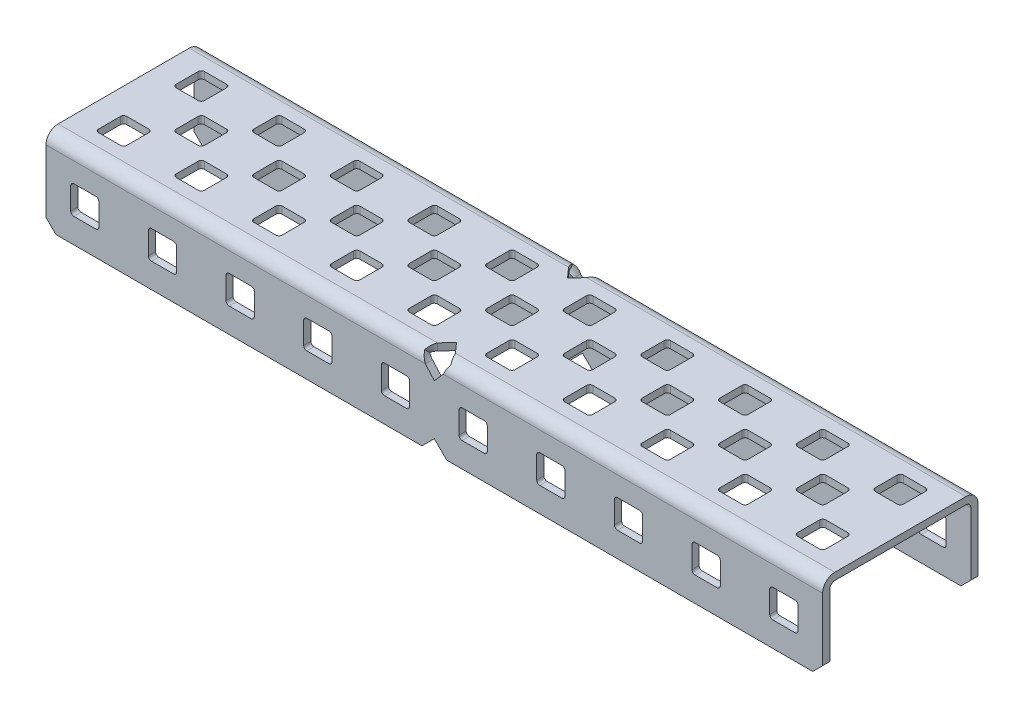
SolidWorks part; units mm, degrees
ref_plane "Front Plane" through (0, 0, 0) normal (0, 0, 1) x (1, 0, 0)
ref_plane "Top Plane" through (0, 0, 0) normal (0, 1, 0) x (1, 0, 0)
ref_plane "Right Plane" through (0, 0, 0) normal (1, 0, 0) x (0, 0, -1)
imported_body "Imported3"
sketch "Sketch1" plane through (0, 0, -14.4322) normal (0, 0, 1) x (1, 0, 0)
  line L0 (35.0078, -12.7) -> (39.0618, -12.7)
  line L1 (39.0618, -12.7) -> (37.0348, -10.673)
  line L2 (37.0348, -10.673) -> (35.0078, -12.7)
extrude "Cut-Extrude1" cut sketch "Sketch1" against normal through all
sketch "Sketch2" plane through (0, 0, 8.631) normal (0, 0, -1) x (-1, 0, 0)
  line L0 (-39.0618, -12.7) -> (-35.0078, -12.7)
  line L1 (-35.0078, -12.7) -> (-37.0348, -10.673)
  line L2 (-37.0348, -10.673) -> (-39.0618, -12.7)
extrude "Cut-Extrude2" cut sketch "Sketch2" against normal through all
sketch "Sketch3" plane through (0, 1.1684, 0) normal (0, 1, 0) x (-1, 0, 0)
  line L0 (-90.1462, -0.5892) -> (-90.1462, -5.212)
  line L1 (-90.1462, -5.212) -> (-85.5234, -5.212)
  line L2 (-85.5234, -5.212) -> (-85.5234, -0.5892)
  line L3 (-85.5234, -0.5892) -> (-90.1462, -0.5892)
extrude "Cut-Extrude3" cut sketch "Sketch3" against normal through all
sketch "Sketch4" plane through (0, 1.1684, 0) normal (0, 1, 0) x (-1, 0, 0)
  line L0 (-77.4462, -0.5892) -> (-77.4462, -5.212)
  line L1 (-77.4462, -5.212) -> (-72.8234, -5.212)
  line L2 (-72.8234, -5.212) -> (-72.8234, -0.5892)
  line L3 (-72.8234, -0.5892) -> (-77.4462, -0.5892)
extrude "Cut-Extrude4" cut sketch "Sketch4" against normal through all
sketch "Sketch5" plane through (0, 1.1684, 0) normal (0, 1, 0) x (-1, 0, 0)
  line L0 (-64.7462, -0.5892) -> (-64.7462, -5.212)
  line L1 (-64.7462, -5.212) -> (-60.1234, -5.212)
  line L2 (-60.1234, -5.212) -> (-60.1234, -0.5892)
  line L3 (-60.1234, -0.5892) -> (-64.7462, -0.5892)
extrude "Cut-Extrude5" cut sketch "Sketch5" against normal through all
sketch "Sketch6" plane through (0, 1.1684, 0) normal (0, 1, 0) x (-1, 0, 0)
  line L0 (-52.0462, -0.5892) -> (-52.0462, -5.212)
  line L1 (-52.0462, -5.212) -> (-47.4234, -5.212)
  line L2 (-47.4234, -5.212) -> (-47.4234, -0.5892)
  line L3 (-47.4234, -0.5892) -> (-52.0462, -0.5892)
extrude "Cut-Extrude6" cut sketch "Sketch6" against normal through all
sketch "Sketch7" plane through (0, 1.1684, 0) normal (0, 1, 0) x (-1, 0, 0)
  line L0 (-39.3462, -0.5892) -> (-39.3462, -5.212)
  line L1 (-39.3462, -5.212) -> (-34.7234, -5.212)
  line L2 (-34.7234, -5.212) -> (-34.7234, -0.5892)
  line L3 (-34.7234, -0.5892) -> (-39.3462, -0.5892)
extrude "Cut-Extrude7" cut sketch "Sketch7" against normal through all
sketch "Sketch8" plane through (0, 1.1684, 0) normal (0, 1, 0) x (-1, 0, 0)
  line L0 (-26.6462, -0.5892) -> (-26.6462, -5.212)
  line L1 (-26.6462, -5.212) -> (-22.0234, -5.212)
  line L2 (-22.0234, -5.212) -> (-22.0234, -0.5892)
  line L3 (-22.0234, -0.5892) -> (-26.6462, -0.5892)
extrude "Cut-Extrude8" cut sketch "Sketch8" against normal through all
sketch "Sketch9" plane through (0, 1.1684, 0) normal (0, 1, 0) x (-1, 0, 0)
  line L0 (-13.9462, -0.5892) -> (-13.9462, -5.212)
  line L1 (-13.9462, -5.212) -> (-9.3234, -5.212)
  line L2 (-9.3234, -5.212) -> (-9.3234, -0.5892)
  line L3 (-9.3234, -0.5892) -> (-13.9462, -0.5892)
extrude "Cut-Extrude9" cut sketch "Sketch9" against normal through all
sketch "Sketch10" plane through (0, 1.1684, 0) normal (0, 1, 0) x (-1, 0, 0)
  line L0 (17.8038, -6.9392) -> (17.8038, -11.562)
  line L1 (17.8038, -11.562) -> (22.4266, -11.562)
  line L2 (22.4266, -11.562) -> (22.4266, -6.9392)
  line L3 (22.4266, -6.9392) -> (17.8038, -6.9392)
extrude "Cut-Extrude10" cut sketch "Sketch10" against normal through all
sketch "Sketch11" plane through (0, 1.1684, 0) normal (0, 1, 0) x (-1, 0, 0)
  line L0 (17.8038, 5.7608) -> (17.8038, 1.138)
  line L1 (17.8038, 1.138) -> (22.4266, 1.138)
  line L2 (22.4266, 1.138) -> (22.4266, 5.7608)
  line L3 (22.4266, 5.7608) -> (17.8038, 5.7608)
extrude "Cut-Extrude11" cut sketch "Sketch11" against normal through all
sketch "Sketch12" plane through (0, 1.1684, 0) normal (0, 1, 0) x (-1, 0, 0)
  line L0 (11.4538, -0.5892) -> (11.4538, -5.212)
  line L1 (11.4538, -5.212) -> (16.0766, -5.212)
  line L2 (16.0766, -5.212) -> (16.0766, -0.5892)
  line L3 (16.0766, -0.5892) -> (11.4538, -0.5892)
extrude "Cut-Extrude12" cut sketch "Sketch12" against normal through all
sketch "Sketch13" plane through (0, 1.1684, 0) normal (0, 1, 0) x (-1, 0, 0)
  line L0 (5.1038, -6.9392) -> (5.1038, -11.562)
  line L1 (5.1038, -11.562) -> (9.7266, -11.562)
  line L2 (9.7266, -11.562) -> (9.7266, -6.9392)
  line L3 (9.7266, -6.9392) -> (5.1038, -6.9392)
extrude "Cut-Extrude13" cut sketch "Sketch13" against normal through all
sketch "Sketch14" plane through (0, 1.1684, 0) normal (0, 1, 0) x (-1, 0, 0)
  line L0 (5.1038, 5.7608) -> (5.1038, 1.138)
  line L1 (5.1038, 1.138) -> (9.7266, 1.138)
  line L2 (9.7266, 1.138) -> (9.7266, 5.7608)
  line L3 (9.7266, 5.7608) -> (5.1038, 5.7608)
extrude "Cut-Extrude14" cut sketch "Sketch14" against normal through all
sketch "Sketch15" plane through (0, 1.1684, 0) normal (0, 1, 0) x (-1, 0, 0)
  line L0 (-7.5962, -6.9392) -> (-7.5962, -11.562)
  line L1 (-7.5962, -11.562) -> (-2.9734, -11.562)
  line L2 (-2.9734, -11.562) -> (-2.9734, -6.9392)
  line L3 (-2.9734, -6.9392) -> (-7.5962, -6.9392)
extrude "Cut-Extrude15" cut sketch "Sketch15" against normal through all
sketch "Sketch16" plane through (0, 1.1684, 0) normal (0, 1, 0) x (-1, 0, 0)
  line L0 (-7.5962, 5.7608) -> (-7.5962, 1.138)
  line L1 (-7.5962, 1.138) -> (-2.9734, 1.138)
  line L2 (-2.9734, 1.138) -> (-2.9734, 5.7608)
  line L3 (-2.9734, 5.7608) -> (-7.5962, 5.7608)
extrude "Cut-Extrude16" cut sketch "Sketch16" against normal through all
sketch "Sketch17" plane through (0, 1.1684, 0) normal (0, 1, 0) x (-1, 0, 0)
  line L0 (-20.2962, -6.9392) -> (-20.2962, -11.562)
  line L1 (-20.2962, -11.562) -> (-15.6734, -11.562)
  line L2 (-15.6734, -11.562) -> (-15.6734, -6.9392)
  line L3 (-15.6734, -6.9392) -> (-20.2962, -6.9392)
extrude "Cut-Extrude17" cut sketch "Sketch17" against normal through all
sketch "Sketch18" plane through (0, 1.1684, 0) normal (0, 1, 0) x (-1, 0, 0)
  line L0 (-20.2962, 5.7608) -> (-20.2962, 1.138)
  line L1 (-20.2962, 1.138) -> (-15.6734, 1.138)
  line L2 (-15.6734, 1.138) -> (-15.6734, 5.7608)
  line L3 (-15.6734, 5.7608) -> (-20.2962, 5.7608)
extrude "Cut-Extrude18" cut sketch "Sketch18" against normal through all
sketch "Sketch19" plane through (0, 1.1684, 0) normal (0, 1, 0) x (-1, 0, 0)
  line L0 (-32.9962, -6.9392) -> (-32.9962, -11.562)
  line L1 (-32.9962, -11.562) -> (-28.3734, -11.562)
  line L2 (-28.3734, -11.562) -> (-28.3734, -6.9392)
  line L3 (-28.3734, -6.9392) -> (-32.9962, -6.9392)
extrude "Cut-Extrude19" cut sketch "Sketch19" against normal through all
sketch "Sketch20" plane through (0, 1.1684, 0) normal (0, 1, 0) x (-1, 0, 0)
  line L0 (-32.9962, 5.7608) -> (-32.9962, 1.138)
  line L1 (-32.9962, 1.138) -> (-28.3734, 1.138)
  line L2 (-28.3734, 1.138) -> (-28.3734, 5.7608)
  line L3 (-28.3734, 5.7608) -> (-32.9962, 5.7608)
extrude "Cut-Extrude20" cut sketch "Sketch20" against normal through all
sketch "Sketch21" plane through (0, 1.1684, 0) normal (0, 1, 0) x (-1, 0, 0)
  line L0 (-45.6962, -6.9392) -> (-45.6962, -11.562)
  line L1 (-45.6962, -11.562) -> (-41.0734, -11.562)
  line L2 (-41.0734, -11.562) -> (-41.0734, -6.9392)
  line L3 (-41.0734, -6.9392) -> (-45.6962, -6.9392)
extrude "Cut-Extrude21" cut sketch "Sketch21" against normal through all
sketch "Sketch22" plane through (0, 1.1684, 0) normal (0, 1, 0) x (-1, 0, 0)
  line L0 (-45.6962, 5.7608) -> (-45.6962, 1.138)
  line L1 (-45.6962, 1.138) -> (-41.0734, 1.138)
  line L2 (-41.0734, 1.138) -> (-41.0734, 5.7608)
  line L3 (-41.0734, 5.7608) -> (-45.6962, 5.7608)
extrude "Cut-Extrude22" cut sketch "Sketch22" against normal through all
sketch "Sketch23" plane through (0, 1.1684, 0) normal (0, 1, 0) x (-1, 0, 0)
  line L0 (-58.3962, -6.9392) -> (-58.3962, -11.562)
  line L1 (-58.3962, -11.562) -> (-53.7734, -11.562)
  line L2 (-53.7734, -11.562) -> (-53.7734, -6.9392)
  line L3 (-53.7734, -6.9392) -> (-58.3962, -6.9392)
extrude "Cut-Extrude23" cut sketch "Sketch23" against normal through all
sketch "Sketch24" plane through (0, 1.1684, 0) normal (0, 1, 0) x (-1, 0, 0)
  line L0 (-58.3962, 5.7608) -> (-58.3962, 1.138)
  line L1 (-58.3962, 1.138) -> (-53.7734, 1.138)
  line L2 (-53.7734, 1.138) -> (-53.7734, 5.7608)
  line L3 (-53.7734, 5.7608) -> (-58.3962, 5.7608)
extrude "Cut-Extrude24" cut sketch "Sketch24" against normal through all
sketch "Sketch25" plane through (0, 1.1684, 0) normal (0, 1, 0) x (-1, 0, 0)
  line L0 (-71.0962, -6.9392) -> (-71.0962, -11.562)
  line L1 (-71.0962, -11.562) -> (-66.4734, -11.562)
  line L2 (-66.4734, -11.562) -> (-66.4734, -6.9392)
  line L3 (-66.4734, -6.9392) -> (-71.0962, -6.9392)
extrude "Cut-Extrude25" cut sketch "Sketch25" against normal through all
sketch "Sketch26" plane through (0, 1.1684, 0) normal (0, 1, 0) x (-1, 0, 0)
  line L0 (-71.0962, 5.7608) -> (-71.0962, 1.138)
  line L1 (-71.0962, 1.138) -> (-66.4734, 1.138)
  line L2 (-66.4734, 1.138) -> (-66.4734, 5.7608)
  line L3 (-66.4734, 5.7608) -> (-71.0962, 5.7608)
extrude "Cut-Extrude26" cut sketch "Sketch26" against normal through all
sketch "Sketch27" plane through (0, 1.1684, 0) normal (0, 1, 0) x (-1, 0, 0)
  line L0 (-83.7962, -6.9392) -> (-83.7962, -11.562)
  line L1 (-83.7962, -11.562) -> (-79.1734, -11.562)
  line L2 (-79.1734, -11.562) -> (-79.1734, -6.9392)
  line L3 (-79.1734, -6.9392) -> (-83.7962, -6.9392)
extrude "Cut-Extrude27" cut sketch "Sketch27" against normal through all
sketch "Sketch28" plane through (0, 1.1684, 0) normal (0, 1, 0) x (-1, 0, 0)
  line L0 (-83.7962, 5.7608) -> (-83.7962, 1.138)
  line L1 (-83.7962, 1.138) -> (-79.1734, 1.138)
  line L2 (-79.1734, 1.138) -> (-79.1734, 5.7608)
  line L3 (-79.1734, 5.7608) -> (-83.7962, 5.7608)
extrude "Cut-Extrude28" cut sketch "Sketch28" against normal through all
sketch "Sketch29" plane through (0, 1.1684, 0) normal (0, 1, 0) x (-1, 0, 0)
  line L0 (-96.4962, -6.9392) -> (-96.4962, -11.562)
  line L1 (-96.4962, -11.562) -> (-91.8734, -11.562)
  line L2 (-91.8734, -11.562) -> (-91.8734, -6.9392)
  line L3 (-91.8734, -6.9392) -> (-96.4962, -6.9392)
extrude "Cut-Extrude29" cut sketch "Sketch29" against normal through all
sketch "Sketch30" plane through (0, 1.1684, 0) normal (0, 1, 0) x (-1, 0, 0)
  line L0 (-96.4962, 5.7608) -> (-96.4962, 1.138)
  line L1 (-96.4962, 1.138) -> (-91.8734, 1.138)
  line L2 (-91.8734, 1.138) -> (-91.8734, 5.7608)
  line L3 (-91.8734, 5.7608) -> (-96.4962, 5.7608)
extrude "Cut-Extrude30" cut sketch "Sketch30" against normal through all
sketch "Sketch31" plane through (0, 0, -14.4322) normal (0, 0, 1) x (1, 0, 0)
  line L0 (-17.8038, -8.6614) -> (-17.8038, -4.0386)
  line L1 (-17.8038, -4.0386) -> (-22.4266, -4.0386)
  line L2 (-22.4266, -4.0386) -> (-22.4266, -8.6614)
  line L3 (-22.4266, -8.6614) -> (-17.8038, -8.6614)
extrude "Cut-Extrude31" cut sketch "Sketch31" against normal through all
sketch "Sketch32" plane through (0, 0, -14.4322) normal (0, 0, 1) x (1, 0, 0)
  line L0 (-5.1038, -8.6614) -> (-5.1038, -4.0386)
  line L1 (-5.1038, -4.0386) -> (-9.7266, -4.0386)
  line L2 (-9.7266, -4.0386) -> (-9.7266, -8.6614)
  line L3 (-9.7266, -8.6614) -> (-5.1038, -8.6614)
extrude "Cut-Extrude32" cut sketch "Sketch32" against normal through all
sketch "Sketch33" plane through (0, 0, -14.4322) normal (0, 0, 1) x (1, 0, 0)
  line L0 (7.5962, -8.6614) -> (7.5962, -4.0386)
  line L1 (7.5962, -4.0386) -> (2.9734, -4.0386)
  line L2 (2.9734, -4.0386) -> (2.9734, -8.6614)
  line L3 (2.9734, -8.6614) -> (7.5962, -8.6614)
extrude "Cut-Extrude33" cut sketch "Sketch33" against normal through all
sketch "Sketch34" plane through (0, 0, -14.4322) normal (0, 0, 1) x (1, 0, 0)
  line L0 (20.2962, -8.6614) -> (20.2962, -4.0386)
  line L1 (20.2962, -4.0386) -> (15.6734, -4.0386)
  line L2 (15.6734, -4.0386) -> (15.6734, -8.6614)
  line L3 (15.6734, -8.6614) -> (20.2962, -8.6614)
extrude "Cut-Extrude34" cut sketch "Sketch34" against normal through all
sketch "Sketch35" plane through (0, 0, -14.4322) normal (0, 0, 1) x (1, 0, 0)
  line L0 (32.9962, -8.6614) -> (32.9962, -4.0386)
  line L1 (32.9962, -4.0386) -> (28.3734, -4.0386)
  line L2 (28.3734, -4.0386) -> (28.3734, -8.6614)
  line L3 (28.3734, -8.6614) -> (32.9962, -8.6614)
extrude "Cut-Extrude35" cut sketch "Sketch35" against normal through all
sketch "Sketch36" plane through (0, 0, -14.4322) normal (0, 0, 1) x (1, 0, 0)
  line L0 (45.6962, -8.6614) -> (45.6962, -4.0386)
  line L1 (45.6962, -4.0386) -> (41.0734, -4.0386)
  line L2 (41.0734, -4.0386) -> (41.0734, -8.6614)
  line L3 (41.0734, -8.6614) -> (45.6962, -8.6614)
extrude "Cut-Extrude36" cut sketch "Sketch36" against normal through all
sketch "Sketch37" plane through (0, 0, -14.4322) normal (0, 0, 1) x (1, 0, 0)
  line L0 (58.3962, -8.6614) -> (58.3962, -4.0386)
  line L1 (58.3962, -4.0386) -> (53.7734, -4.0386)
  line L2 (53.7734, -4.0386) -> (53.7734, -8.6614)
  line L3 (53.7734, -8.6614) -> (58.3962, -8.6614)
extrude "Cut-Extrude37" cut sketch "Sketch37" against normal through all
sketch "Sketch38" plane through (0, 0, -14.4322) normal (0, 0, 1) x (1, 0, 0)
  line L0 (71.0962, -8.6614) -> (71.0962, -4.0386)
  line L1 (71.0962, -4.0386) -> (66.4734, -4.0386)
  line L2 (66.4734, -4.0386) -> (66.4734, -8.6614)
  line L3 (66.4734, -8.6614) -> (71.0962, -8.6614)
extrude "Cut-Extrude38" cut sketch "Sketch38" against normal through all
sketch "Sketch39" plane through (0, 0, -14.4322) normal (0, 0, 1) x (1, 0, 0)
  line L0 (83.7962, -8.6614) -> (83.7962, -4.0386)
  line L1 (83.7962, -4.0386) -> (79.1734, -4.0386)
  line L2 (79.1734, -4.0386) -> (79.1734, -8.6614)
  line L3 (79.1734, -8.6614) -> (83.7962, -8.6614)
extrude "Cut-Extrude39" cut sketch "Sketch39" against normal through all
sketch "Sketch40" plane through (0, 0, -14.4322) normal (0, 0, 1) x (1, 0, 0)
  line L0 (96.4962, -8.6614) -> (96.4962, -4.0386)
  line L1 (96.4962, -4.0386) -> (91.8734, -4.0386)
  line L2 (91.8734, -4.0386) -> (91.8734, -8.6614)
  line L3 (91.8734, -8.6614) -> (96.4962, -8.6614)
extrude "Cut-Extrude40" cut sketch "Sketch40" against normal through all
sketch "Sketch41" plane through (0, 0, 8.631) normal (0, 0, -1) x (-1, 0, 0)
  line L0 (17.8038, -4.0386) -> (17.8038, -8.6614)
  line L1 (17.8038, -8.6614) -> (22.4266, -8.6614)
  line L2 (22.4266, -8.6614) -> (22.4266, -4.0386)
  line L3 (22.4266, -4.0386) -> (17.8038, -4.0386)
extrude "Cut-Extrude41" cut sketch "Sketch41" against normal through all
sketch "Sketch42" plane through (0, 0, 8.631) normal (0, 0, -1) x (-1, 0, 0)
  line L0 (5.1038, -4.0386) -> (5.1038, -8.6614)
  line L1 (5.1038, -8.6614) -> (9.7266, -8.6614)
  line L2 (9.7266, -8.6614) -> (9.7266, -4.0386)
  line L3 (9.7266, -4.0386) -> (5.1038, -4.0386)
extrude "Cut-Extrude42" cut sketch "Sketch42" against normal through all
sketch "Sketch43" plane through (0, 0, 8.631) normal (0, 0, -1) x (-1, 0, 0)
  line L0 (-7.5962, -4.0386) -> (-7.5962, -8.6614)
  line L1 (-7.5962, -8.6614) -> (-2.9734, -8.6614)
  line L2 (-2.9734, -8.6614) -> (-2.9734, -4.0386)
  line L3 (-2.9734, -4.0386) -> (-7.5962, -4.0386)
extrude "Cut-Extrude43" cut sketch "Sketch43" against normal through all
sketch "Sketch44" plane through (0, 0, 8.631) normal (0, 0, -1) x (-1, 0, 0)
  line L0 (-20.2962, -4.0386) -> (-20.2962, -8.6614)
  line L1 (-20.2962, -8.6614) -> (-15.6734, -8.6614)
  line L2 (-15.6734, -8.6614) -> (-15.6734, -4.0386)
  line L3 (-15.6734, -4.0386) -> (-20.2962, -4.0386)
extrude "Cut-Extrude44" cut sketch "Sketch44" against normal through all
sketch "Sketch45" plane through (0, 0, 8.631) normal (0, 0, -1) x (-1, 0, 0)
  line L0 (-32.9962, -4.0386) -> (-32.9962, -8.6614)
  line L1 (-32.9962, -8.6614) -> (-28.3734, -8.6614)
  line L2 (-28.3734, -8.6614) -> (-28.3734, -4.0386)
  line L3 (-28.3734, -4.0386) -> (-32.9962, -4.0386)
extrude "Cut-Extrude45" cut sketch "Sketch45" against normal through all
sketch "Sketch46" plane through (0, 0, 8.631) normal (0, 0, -1) x (-1, 0, 0)
  line L0 (-45.6962, -4.0386) -> (-45.6962, -8.6614)
  line L1 (-45.6962, -8.6614) -> (-41.0734, -8.6614)
  line L2 (-41.0734, -8.6614) -> (-41.0734, -4.0386)
  line L3 (-41.0734, -4.0386) -> (-45.6962, -4.0386)
extrude "Cut-Extrude46" cut sketch "Sketch46" against normal through all
sketch "Sketch47" plane through (0, 0, 8.631) normal (0, 0, -1) x (-1, 0, 0)
  line L0 (-58.3962, -4.0386) -> (-58.3962, -8.6614)
  line L1 (-58.3962, -8.6614) -> (-53.7734, -8.6614)
  line L2 (-53.7734, -8.6614) -> (-53.7734, -4.0386)
  line L3 (-53.7734, -4.0386) -> (-58.3962, -4.0386)
extrude "Cut-Extrude47" cut sketch "Sketch47" against normal through all
sketch "Sketch48" plane through (0, 0, 8.631) normal (0, 0, -1) x (-1, 0, 0)
  line L0 (-71.0962, -4.0386) -> (-71.0962, -8.6614)
  line L1 (-71.0962, -8.6614) -> (-66.4734, -8.6614)
  line L2 (-66.4734, -8.6614) -> (-66.4734, -4.0386)
  line L3 (-66.4734, -4.0386) -> (-71.0962, -4.0386)
extrude "Cut-Extrude48" cut sketch "Sketch48" against normal through all
sketch "Sketch49" plane through (0, 0, 8.631) normal (0, 0, -1) x (-1, 0, 0)
  line L0 (-83.7962, -4.0386) -> (-83.7962, -8.6614)
  line L1 (-83.7962, -8.6614) -> (-79.1734, -8.6614)
  line L2 (-79.1734, -8.6614) -> (-79.1734, -4.0386)
  line L3 (-79.1734, -4.0386) -> (-83.7962, -4.0386)
extrude "Cut-Extrude49" cut sketch "Sketch49" against normal through all
sketch "Sketch50" plane through (0, 0, 8.631) normal (0, 0, -1) x (-1, 0, 0)
  line L0 (-96.4962, -4.0386) -> (-96.4962, -8.6614)
  line L1 (-96.4962, -8.6614) -> (-91.8734, -8.6614)
  line L2 (-91.8734, -8.6614) -> (-91.8734, -4.0386)
  line L3 (-91.8734, -4.0386) -> (-96.4962, -4.0386)
extrude "Cut-Extrude50" cut sketch "Sketch50" against normal through all
sketch "Sketch51" plane through (0, 0, 0) normal (0, -1, 0) x (1, 0, 0)
  line L0 (-3.3766, -5.212) -> (1.2462, -5.212)
  line L1 (1.2462, -5.212) -> (1.2462, -0.5892)
  line L2 (1.2462, -0.5892) -> (-3.3766, -0.5892)
  line L3 (-3.3766, -0.5892) -> (-3.3766, -5.212)
extrude "Cut-Extrude51" cut sketch "Sketch51" against normal through all
chamfer "Chamfer1" distance 1.6256 angle 45 4 edges at (-26.4652, -12.7, -15.0164) (-26.4652, -12.7, 9.2152) (100.5348, -12.7, -15.0164) (100.5348, -12.7, 9.2152)
fillet "Fillet1" radius 0.508 102 edges at (85.5234, 0.5842, -0.5892) (-17.8038, 0.5842, 1.138) (58.3962, 0.5842, -11.562) (71.0962, -4.0386, -15.0164) (53.7734, -4.0386, -15.0164) (20.2962, 0.5842, -11.562) (58.3962, -8.6614, -15.0164) (9.3234, 0.5842, -0.5892) (60.1234, 0.5842, -0.5892) (45.6962, -8.6614, -15.0164) (58.3962, 0.5842, 1.138) (41.0734, -8.6614, -15.0164) (45.6962, 0.5842, 1.138) (28.3734, -4.0386, -15.0164) (32.9962, -4.0386, -15.0164) (20.2962, 0.5842, 1.138) (32.9962, -8.6614, -15.0164) (7.5962, 0.5842, 1.138) (-5.1038, 0.5842, 1.138) (15.6734, -4.0386, -15.0164) (20.2962, -4.0386, -15.0164) (2.9734, -4.0386, -15.0164) (72.8234, 0.5842, -0.5892) (7.5962, -4.0386, -15.0164) (66.4734, 0.5842, -6.9392) (-9.7266, -4.0386, -15.0164) (53.7734, 0.5842, -6.9392) (-5.1038, -4.0386, -15.0164) (41.0734, 0.5842, 5.7608) (-9.7266, -8.6614, -15.0164) (-22.4266, -4.0386, -15.0164) (-17.8038, -4.0386, -15.0164) (-22.4266, -8.6614, -15.0164) (2.9734, 0.5842, 5.7608) (91.8734, -8.6614, 9.2152) (2.9734, 0.5842, -6.9392) (96.4962, -8.6614, 9.2152) (-9.7266, 0.5842, 5.7608) (91.8734, -4.0386, 9.2152) (79.1734, -8.6614, 9.2152) (-22.4266, 0.5842, 5.7608) (83.7962, -8.6614, 9.2152) (-22.4266, 0.5842, -6.9392) (26.6462, 0.5842, -5.212) (66.4734, -8.6614, 9.2152) (64.7462, 0.5842, -5.212) (66.4734, -4.0386, 9.2152) (53.7734, -8.6614, 9.2152) (90.1462, 0.5842, -5.212) (58.3962, -8.6614, 9.2152) (79.1734, -8.6614, -15.0164) (58.3962, -4.0386, 9.2152) (71.0962, 0.5842, -6.9392) (45.6962, -4.0386, 9.2152) (53.7734, 0.5842, 1.138) (41.0734, -4.0386, 9.2152) (53.7734, 0.5842, -11.562) (45.6962, 0.5842, 5.7608) (41.0734, 0.5842, 1.138) (28.3734, -4.0386, 9.2152) (45.6962, 0.5842, -6.9392) (41.0734, 0.5842, -11.562) (20.2962, -8.6614, 9.2152) (32.9962, 0.5842, 5.7608) (20.2962, -4.0386, 9.2152) (32.9962, 0.5842, -6.9392) (28.3734, 0.5842, -11.562) (7.5962, -8.6614, 9.2152) (7.5962, -4.0386, 9.2152) (15.6734, 0.5842, 1.138) (2.9734, -4.0386, 9.2152) (15.6734, 0.5842, -11.562) (7.5962, 0.5842, 5.7608) (2.9734, 0.5842, 1.138) (-22.4266, -8.6614, 9.2152) (2.9734, 0.5842, -11.562) (-17.8038, -8.6614, 9.2152) (-17.8038, -4.0386, 9.2152) (-22.4266, -4.0386, 9.2152) (-9.7266, 0.5842, -11.562) (96.4962, -4.0386, -15.0164) (1.2462, 0.5842, -5.212) (-22.4266, 0.5842, 1.138) (-17.8038, 0.5842, -6.9392) (-3.3766, 0.5842, -0.5892) (-22.4266, 0.5842, -11.562) (91.8734, 0.5842, 1.138) (26.6462, 0.5842, -0.5892) (96.4962, 0.5842, -6.9392) (39.3462, 0.5842, -0.5892) (91.8734, 0.5842, -6.9392) (47.4234, 0.5842, -5.212) (91.8734, 0.5842, -11.562) (52.0462, 0.5842, -0.5892) (60.1234, 0.5842, -5.212) (79.1734, -4.0386, -15.0164) (85.5234, 0.5842, -5.212) (90.1462, 0.5842, -0.5892) (79.1734, 0.5842, -11.562) (83.7962, 0.5842, -11.562) (83.7962, 0.5842, -6.9392) (79.1734, 0.5842, -6.9392)
fillet "Fillet2" radius 0.8128 4 edges at (69.8595, 0, 8.631) (4.2101, 0, 8.631) (69.8595, 0, -14.4322) (4.2101, 0, -14.4322)
fillet "Fillet3" radius 1.9812 4 edges at (4.2101, 1.1684, -15.6006) (69.8595, 1.1684, 9.7994) (4.2101, 1.1684, 9.7994) (69.8595, 1.1684, -15.6006)
